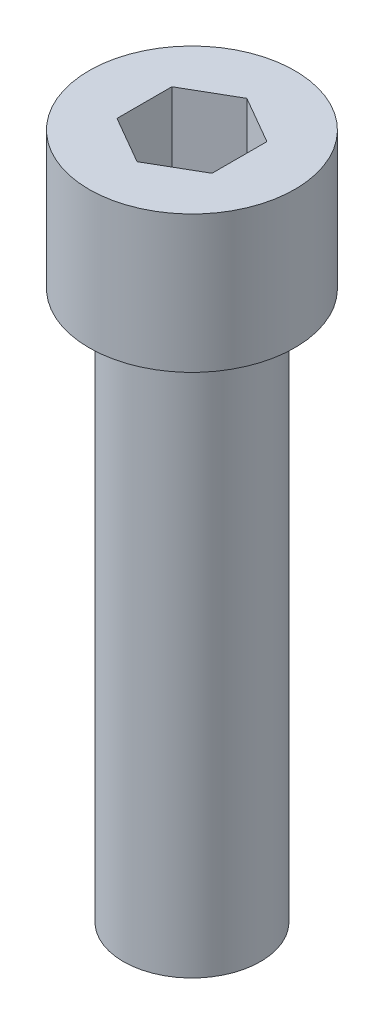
SolidWorks part; units mm, degrees
ref_plane "Front" through (0, 0, 0) normal (0, 0, 1) x (1, 0, 0)
ref_plane "Top" through (0, 0, 0) normal (0, 1, 0) x (1, 0, 0)
ref_plane "Right" through (0, 0, 0) normal (1, 0, 0) x (0, 0, -1)
sketch "Sketch1" plane through (0, 0, 0) normal (0, 0, 1) x (1, 0, 0)
  line L0 (0, 66.04) -> (0, -99.06) construction
  line L1 (0, 0) -> (-4.7625, 0)
  line L2 (-4.7625, 0) -> (-4.7625, -6.35)
  line L3 (-4.7625, -6.35) -> (-3.175, -6.35)
  line L4 (-3.175, -6.35) -> (-3.175, -31.75)
  line L5 (-3.175, -31.75) -> (0, -31.75)
  line L6 (0, 0) -> (0, -31.75)
  dimension "D1" = 9.525
  dimension "D2" = 6.35
  dimension "D3" = 6.35
  dimension "D4" = 25.4
revolve "Revolve1" add sketch "Sketch1" angle 360 about L0
sketch "Sketch2" plane through (0, 0, 0) normal (0, 1, 0) x (-1, 0, 0)
  line L0 (-10.16, 0) -> (12.7, 0) construction
  line L1 (0, -12.7) -> (0, 12.7) construction
  line L3 (0, -2.54) -> (2.1997, -1.27)
  line L4 (2.1997, -1.27) -> (2.1997, 1.27)
  line L5 (2.1997, 1.27) -> (0, 2.54)
  line L6 (0, 2.54) -> (-2.1997, 1.27)
  line L7 (-2.1997, 1.27) -> (-2.1997, -1.27)
  line L8 (-2.1997, -1.27) -> (0, -2.54)
  circle A0 centre (0, 0) radius 2.1997 construction
extrude "Cut-Extrude1" cut sketch "Sketch2" against normal blind 6.35
